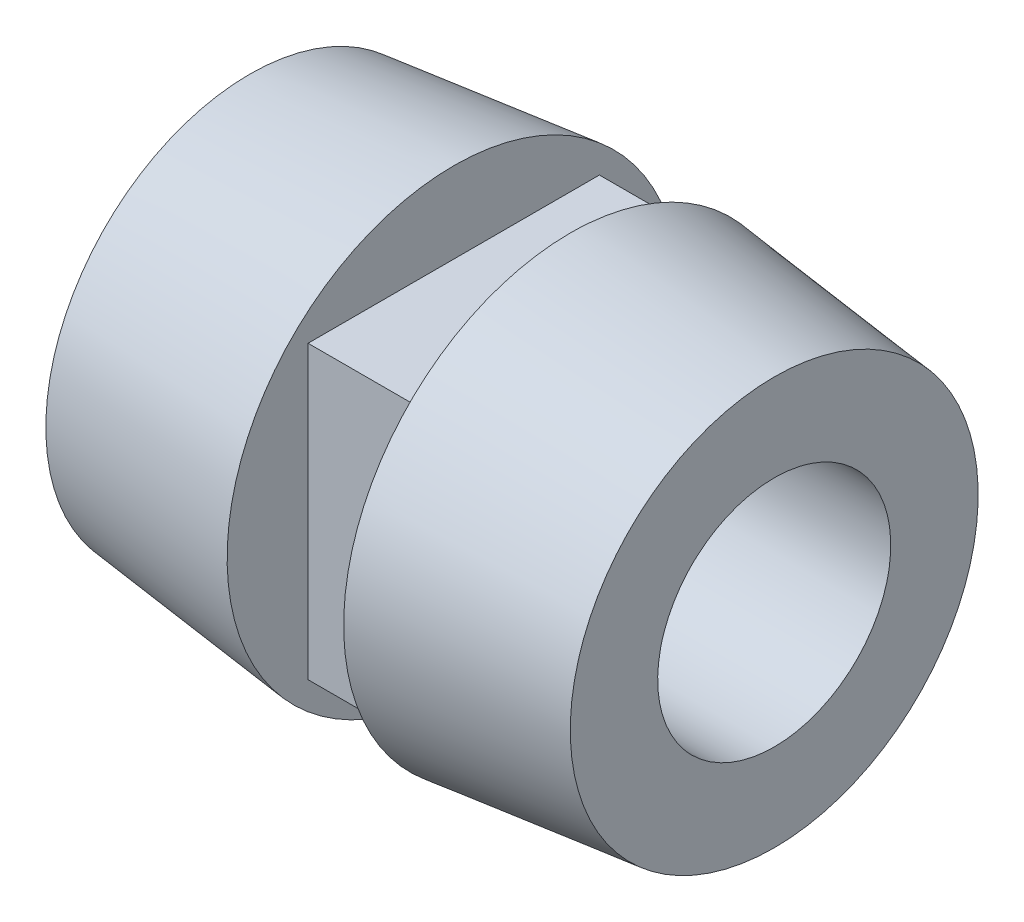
SolidWorks part; units mm, degrees
ref_plane "Plan de face" through (0, 0, 0) normal (0, 0, 1) x (1, 0, 0)
ref_plane "Plan de dessus" through (0, 0, 0) normal (0, 1, 0) x (1, 0, 0)
ref_plane "Plan de droite" through (0, 0, 0) normal (1, 0, 0) x (0, 0, -1)
sketch "Esquisse1" plane through (0, 0, 0) normal (0, 0, 1) x (1, 0, 0)
  line L0 (0, 0) -> (0, 8) construction
  line L1 (-4.5, 0) -> (-4.5, 3.5)
  line L2 (-4.5, 3.5) -> (0, 4)
  line L3 (0, 4) -> (4.5, 3.5)
  line L4 (-15.1617, 0.0001) -> (10.3255, 0) construction
  line L5 (4.5, 3.5) -> (4.5, 0)
  line L6 (4.5, 0) -> (-4.5, 0)
  dimension "D1" = 9
  dimension "D2" = 4.5
  dimension "D3" = 3.5
  dimension "D4" = 3.5
  dimension "D5" = 4
revolve "Révolution4" add sketch "Esquisse1" angle 360 about L4
sketch "Esquisse2" plane through (0, 0, 0) normal (1, 0, 0) x (0, 0, -1)
  line L1 (-2.5, 2.5) -> (2.5, 2.5)
  line L2 (-2.5, 2.5) -> (-2.5, -2.5)
  line L3 (-2.5, -2.5) -> (2.5, -2.5)
  line L4 (2.5, 2.5) -> (2.5, -2.5)
  dimension "D1" = 5
  dimension "D2" = 5
  dimension "D3" = 2.5
  dimension "D4" = 2.5
extrude "Enlèv. mat.-Extru.1" cut sketch "Esquisse2" against normal mid plane 2 flip side to cut
sketch "Esquisse4" plane through (0, 0, 0) normal (1, 0, 0) x (0, 0, -1)
  circle A0 centre (0, 0) radius 2
  dimension "D1" = 4
extrude "Enlèv. mat.-Extru.2" cut sketch "Esquisse4" against normal through all and the other way through all
ref_plane "Plan1" through (4.5, 0, 0) normal (1, 0, 0) x (0, 0, -1)
